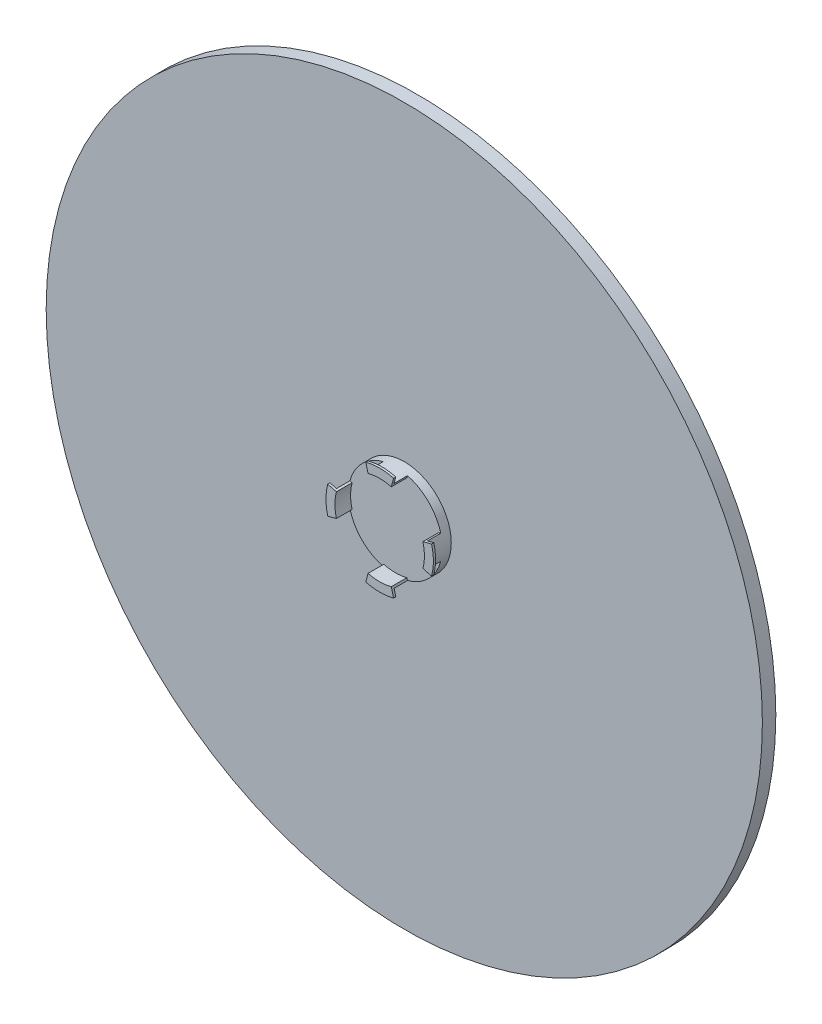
SolidWorks part; units mm, degrees
ref_plane "Plan de face" through (0, 0, 0) normal (0, 0, 1) x (1, 0, 0)
ref_plane "Plan de dessus" through (0, 0, 0) normal (0, 1, 0) x (1, 0, 0)
ref_plane "Plan de droite" through (0, 0, 0) normal (1, 0, 0) x (0, 0, -1)
sketch "Esquisse1" plane through (0, 0, 0) normal (0, 0, 1) x (1, 0, 0)
  line L0 (0, 800) -> (0, 0) construction
  line L1 (0, -55) -> (0, 55) construction
  line L2 (0, 0) -> (692.8203, -400) construction
  line L3 (0, 0) -> (-692.8203, -400) construction
  circle A0 centre (0, 0) radius 800
  dimension "D1" = 1600
extrude "Extrusion1" add sketch "Esquisse1" along normal blind 30
sketch "Esquisse3" plane through (0, 0, 30) normal (0, 0, 1) x (1, 0, 0)
  circle A0 centre (0, 0) radius 105
  dimension "D1" = 210
extrude "Extrusion2" add sketch "Esquisse3" along normal blind 20
sketch "Esquisse4" plane through (0, 0, 50) normal (0, 0, 1) x (1, 0, 0)
  line L0 (0, -105) -> (0, 105) construction
  line L1 (-105, 0) -> (105, 0) construction
  line L2 (-25.8819, 96.5926) -> (-27.176, 101.4222)
  line L3 (25.8819, 96.5926) -> (27.176, 101.4222)
  line L4 (96.5926, 25.8819) -> (101.4222, 27.176)
  line L5 (96.5926, -25.8819) -> (101.4222, -27.176)
  line L6 (-25.8819, -96.5926) -> (-27.176, -101.4222)
  line L7 (25.8819, -96.5926) -> (27.176, -101.4222)
  line L8 (-96.5926, 25.8819) -> (-101.4222, 27.176)
  line L9 (-96.5926, -25.8819) -> (-101.4222, -27.176)
  arc A0 (27.176, 101.4222) -> (-27.176, 101.4222) centre (0, 0) ccw
  arc A3 (96.5926, -25.8819) -> (96.5926, 25.8819) centre (0, 0) ccw
  arc A4 (101.4222, -27.176) -> (101.4222, 27.176) centre (0, 0) ccw
  arc A5 (25.8819, 96.5926) -> (-25.8819, 96.5926) centre (0, 0) ccw
  arc A7 (-101.4222, 27.176) -> (-101.4222, -27.176) centre (0, 0) ccw
  arc A8 (-96.5926, 25.8819) -> (-96.5926, -25.8819) centre (0, 0) ccw
  arc A10 (-25.8819, -96.5926) -> (25.8819, -96.5926) centre (0, 0) ccw
  arc A11 (-27.176, -101.4222) -> (27.176, -101.4222) centre (0, 0) ccw
  dimension "D1" = 210
  dimension "D2" = 15
  dimension "D3" = 15
  dimension "D4" = 15
  dimension "D5" = 15
  dimension "D6" = 15
  dimension "D7" = 15
  dimension "D8" = 15
extrude "Extrusion3" add sketch "Esquisse4" along normal blind 30
sketch "Esquisse6" plane through (0, 0, 80) normal (0, 0, 1) x (1, 0, 0)
  line L0 (-25.8819, 96.5926) -> (-31.0583, 115.9111)
  line L1 (25.8819, 96.5926) -> (31.0583, 115.9111)
  line L2 (96.5926, 25.8819) -> (115.9111, 31.0583)
  line L3 (96.5926, -25.8819) -> (115.9111, -31.0583)
  line L4 (-96.5926, 25.8819) -> (-115.9111, 31.0583)
  line L5 (-96.5926, -25.8819) -> (-115.9111, -31.0583)
  line L6 (-25.8819, -96.5926) -> (-31.0583, -115.9111)
  line L7 (25.8819, -96.5926) -> (31.0583, -115.9111)
  arc A0 (-25.8819, -96.5926) -> (25.8819, -96.5926) centre (0, 0) ccw
  arc A1 (-31.0583, -115.9111) -> (31.0583, -115.9111) centre (0, 0) ccw
  arc A2 (96.5926, -25.8819) -> (96.5926, 25.8819) centre (0, 0) ccw
  arc A3 (115.9111, -31.0583) -> (115.9111, 31.0583) centre (0, 0) ccw
  arc A4 (-96.5926, 25.8819) -> (-96.5926, -25.8819) centre (0, 0) ccw
  arc A5 (-115.9111, 31.0583) -> (-115.9111, -31.0583) centre (0, 0) ccw
  arc A6 (25.8819, 96.5926) -> (-25.8819, 96.5926) centre (0, 0) ccw
  arc A7 (31.0583, 115.9111) -> (-31.0583, 115.9111) centre (0, 0) ccw
  dimension "D1" = 240
extrude "Extrusion5" add sketch "Esquisse6" along normal blind 5
